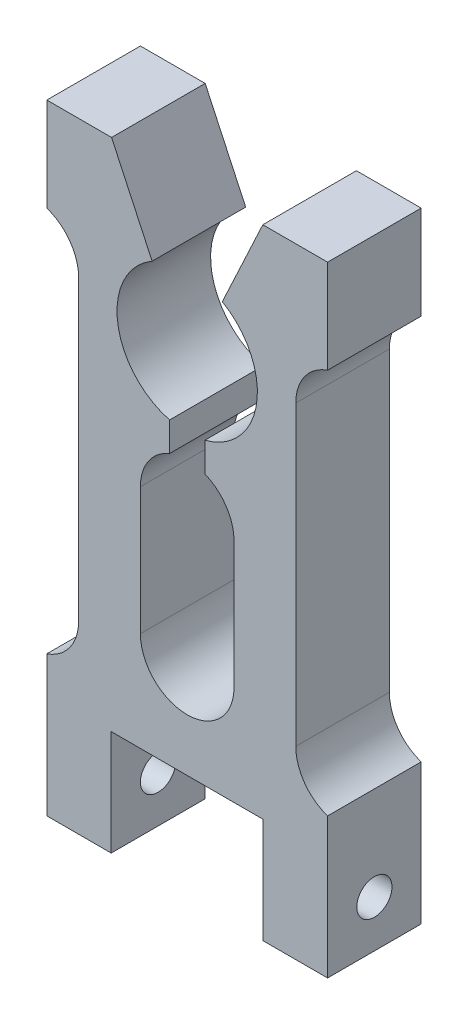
SolidWorks part; units mm, degrees
ref_plane "Front Plane" through (0, 0, 0) normal (0, 0, 1) x (1, 0, 0)
ref_plane "Top Plane" through (0, 0, 0) normal (0, 1, 0) x (1, 0, 0)
ref_plane "Right Plane" through (0, 0, 0) normal (1, 0, 0) x (0, 0, -1)
sketch "Sketch1" plane through (0, 0, 0) normal (0, 0, 1) x (1, 0, 0)
  line L0 (0, 0) -> (0, 34.8649) construction
  line L1 (2.3876, -13.166) -> (2.3876, -9.2209)
  line L2 (-2.3876, -13.166) -> (-2.3876, -9.2209)
  line L3 (4.7625, 8.2489) -> (10.2611, 20.0406)
  line L4 (10.2611, 20.0406) -> (19.05, 20.0406)
  line L5 (19.05, 20.0406) -> (19.05, -64.0842)
  line L6 (-4.7625, 8.2489) -> (-10.2611, 20.0406)
  line L7 (-10.2611, 20.0406) -> (-19.05, 20.0406)
  line L8 (-19.05, 20.0406) -> (-19.05, -64.0842)
  line L9 (-19.05, -64.0842) -> (-10.3124, -64.0842)
  line L10 (-10.3124, -64.0842) -> (-10.3124, -49.8094)
  line L11 (-10.3124, -49.8094) -> (10.3124, -49.8094)
  line L12 (10.3124, -49.8094) -> (10.3124, -64.0842)
  line L13 (10.3124, -64.0842) -> (19.05, -64.0842)
  line L14 (0, -36.322) -> (0, -19.05) construction
  line L15 (-6.35, -36.322) -> (-6.35, -19.05)
  line L16 (6.35, -36.322) -> (6.35, -19.05)
  line L17 (0, -57.7342) -> (19.05, -57.7342)
  line L18 (-14.732, 1.3245) -> (-14.732, -39.0181)
  line L19 (14.732, 1.3245) -> (14.732, -39.0181)
  circle A0 centre (0, 0) radius 9.525
  arc A1 (-6.35, -36.322) -> (6.35, -36.322) centre (0, -36.322) ccw
  arc A2 (6.35, -19.05) -> (-6.35, -19.05) centre (0, -19.05) ccw
  arc A3 (-14.732, -39.0181) -> (-19.05, -45.0342) centre (-21.082, -39.0181) cw
  arc A4 (-14.732, 1.3245) -> (-19.05, 7.3406) centre (-21.082, 1.3245) ccw
  arc A5 (14.732, -39.0181) -> (19.05, -45.0342) centre (21.082, -39.0181) ccw
  arc A6 (14.732, 1.3245) -> (19.05, 7.3406) centre (21.082, 1.3245) cw
  point P20 (0, -27.686)
  dimension "D1" = 19.05
  dimension "D2" = 12.7
  dimension "D14" = 6.35
  dimension "D3" = 19.05
  dimension "D4" = 9.525
  dimension "D5" = 25
  dimension "D6" = 38.1
  dimension "D7" = 20.6248
  dimension "D8" = 14.2748
  dimension "D9" = 13.4874
  dimension "D10" = 4.7752
  dimension "D11" = 64.0842
  dimension "D12" = 84.1248
  dimension "D13" = 6.35
  dimension "D15" = 29.464
  dimension "D16" = 12.7
  dimension "D17" = 19.05
  dimension "D18" = 7.1374
sketch "Sketch2" plane through (0, 0, 0) normal (0, 0, 1) x (1, 0, 0)
  line L0 (-10.3124, -49.8094) -> (10.3124, -49.8094) construction
  line L1 (-10.3124, -64.0842) -> (-10.3124, -49.8094) construction
  line L2 (10.3124, -49.8094) -> (10.3124, -64.0842) construction
  line L3 (10.3124, -64.0842) -> (19.05, -64.0842) construction
  line L4 (19.05, 20.0406) -> (19.05, -64.0842) construction
  line L5 (-19.05, -64.0842) -> (-10.3124, -64.0842) construction
  line L6 (-19.05, 20.0406) -> (-19.05, -64.0842) construction
  line L7 (2.3876, -13.166) -> (2.3876, -9.2209) construction
  line L8 (-2.3876, -13.166) -> (-2.3876, -9.2209) construction
  line L9 (-10.2611, 20.0406) -> (-19.05, 20.0406) construction
  line L10 (-4.7625, 8.2489) -> (-10.2611, 20.0406) construction
  line L11 (4.7625, 8.2489) -> (10.2611, 20.0406) construction
  line L12 (10.2611, 20.0406) -> (19.05, 20.0406) construction
  line L13 (-10.3124, -49.8094) -> (10.3124, -49.8094)
  line L14 (-10.3124, -64.0842) -> (-10.3124, -49.8094)
  line L15 (10.3124, -49.8094) -> (10.3124, -64.0842)
  line L16 (10.3124, -64.0842) -> (19.05, -64.0842)
  line L17 (19.05, 20.0406) -> (19.05, 7.3406)
  line L18 (-19.05, -64.0842) -> (-10.3124, -64.0842)
  line L19 (-19.05, 20.0406) -> (-19.05, 7.3406)
  line L20 (2.3876, -13.166) -> (2.3876, -9.2209)
  line L21 (-2.3876, -13.166) -> (-2.3876, -9.2209)
  line L22 (-10.2611, 20.0406) -> (-19.05, 20.0406)
  line L23 (-4.7625, 8.2489) -> (-10.2611, 20.0406)
  line L24 (4.7625, 8.2489) -> (10.2611, 20.0406)
  line L25 (10.2611, 20.0406) -> (19.05, 20.0406)
  line L26 (-6.35, -36.322) -> (-6.35, -19.05) construction
  line L27 (6.35, -36.322) -> (6.35, -19.05) construction
  line L28 (-6.35, -36.322) -> (-6.35, -19.05)
  line L29 (6.35, -36.322) -> (6.35, -19.05)
  line L30 (-14.732, 1.3245) -> (-14.732, -39.0181) construction
  line L31 (14.732, 1.3245) -> (14.732, -39.0181) construction
  line L32 (-14.732, 1.3245) -> (-14.732, -39.0181)
  line L33 (14.732, 1.3245) -> (14.732, -39.0181)
  line L34 (-19.05, -45.0342) -> (-19.05, -64.0842)
  line L35 (19.05, -45.0342) -> (19.05, -64.0842)
  arc A0 (-6.35, -36.322) -> (6.35, -36.322) centre (0, -36.322) ccw construction
  circle A1 centre (0, 0) radius 9.525 construction
  arc A2 (-6.35, -36.322) -> (6.35, -36.322) centre (0, -36.322) ccw
  arc A3 (-4.7625, 8.2489) -> (-2.3876, -9.2209) centre (0, 0) ccw
  arc A4 (2.3876, -9.2209) -> (4.7625, 8.2489) centre (0, 0) ccw
  arc A5 (6.35, -19.05) -> (-6.35, -19.05) centre (0, -19.05) ccw construction
  arc A6 (6.35, -19.05) -> (2.3876, -13.166) centre (0, -19.05) ccw
  arc A7 (-2.3876, -13.166) -> (-6.35, -19.05) centre (0, -19.05) ccw
  arc A8 (-19.05, -45.0342) -> (-14.732, -39.0181) centre (-21.082, -39.0181) ccw construction
  arc A9 (-14.732, 1.3245) -> (-19.05, 7.3406) centre (-21.082, 1.3245) ccw construction
  arc A10 (19.05, 7.3406) -> (14.732, 1.3245) centre (21.082, 1.3245) ccw construction
  arc A11 (14.732, -39.0181) -> (19.05, -45.0342) centre (21.082, -39.0181) ccw construction
  arc A12 (-19.05, -45.0342) -> (-14.732, -39.0181) centre (-21.082, -39.0181) ccw
  arc A13 (-14.732, 1.3245) -> (-19.05, 7.3406) centre (-21.082, 1.3245) ccw
  arc A14 (19.05, 7.3406) -> (14.732, 1.3245) centre (21.082, 1.3245) ccw
  arc A15 (14.732, -39.0181) -> (19.05, -45.0342) centre (21.082, -39.0181) ccw
extrude "Boss-Extrude1" add sketch "Sketch2" along normal mid plane 12.7
sketch "Sketch4" plane through (0, 0, 0) normal (1, 0, 0) x (0, 0, -1)
  circle A0 centre (0, -57.7342) radius 2.3876
  dimension "D1" = 4.7752
extrude "Cut-Extrude2" cut sketch "Sketch4" against normal mid plane 76.2
